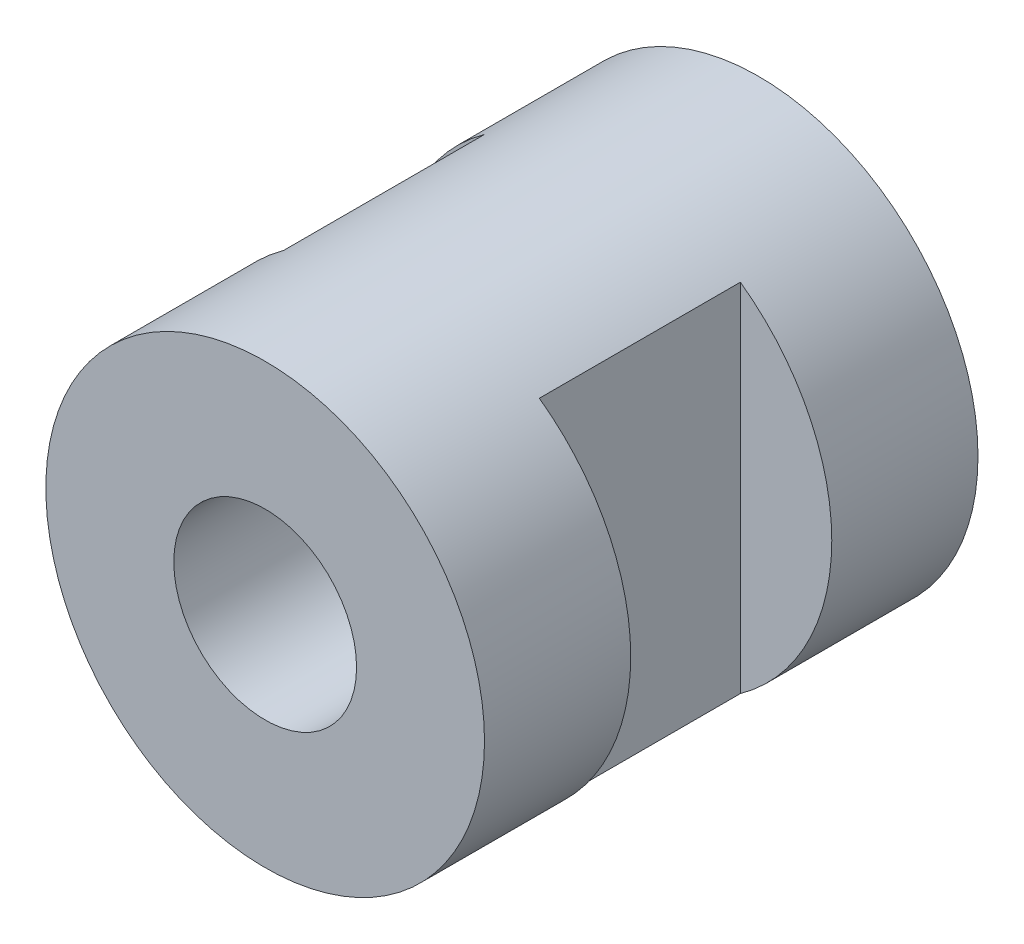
SolidWorks part; units mm, degrees
ref_plane "前视基准面" through (0, 0, 0) normal (0, 0, 1) x (1, 0, 0)
ref_plane "上视基准面" through (0, 0, 0) normal (0, 1, 0) x (1, 0, 0)
ref_plane "右视基准面" through (0, 0, 0) normal (1, 0, 0) x (0, 0, -1)
sketch "草图1" plane through (0, 0, 0) normal (0, 0, 1) x (1, 0, 0)
  circle A0 centre (0, 0) radius 6
extrude "凸台-拉伸1" add sketch "草图1" along normal blind 13.5
ref_plane "基准面1" through (0, 10, 0) normal (0, 1, 0) x (-1, 0, 0)
sketch "草图2" plane through (0, 10, 0) normal (0, 1, 0) x (-1, 0, 0)
  line L0 (-6, 13.5) -> (-6, 0) construction
  line L1 (-7.7864, 9.5) -> (-3.5, 9.5)
  line L2 (-7.7864, 9.5) -> (-7.7864, 4)
  line L3 (-7.7864, 4) -> (-3.5, 4)
  line L4 (-3.5, 9.5) -> (-3.5, 4)
  line L5 (0, 13.5) -> (0, 0) construction
  line L6 (6, 13.5) -> (-6, 13.5) construction
  line L7 (0, 6.75) -> (6.444, 6.75) construction
  line L8 (7.7864, 9.5) -> (7.7864, 4)
  line L9 (7.7864, 4) -> (3.5, 4)
  line L10 (3.5, 9.5) -> (3.5, 4)
  line L11 (7.7864, 9.5) -> (3.5, 9.5)
  dimension "D1" = 2.5
  dimension "D2" = 5.5
extrude "切除-拉伸1" cut sketch "草图2" against normal through all
sketch "草图3" plane through (0, 0, 0) normal (0, 0, -1) x (-1, 0, 0)
  circle A0 centre (0, 0) radius 2.5
extrude "切除-拉伸2" cut sketch "草图3" against normal blind 13.5
